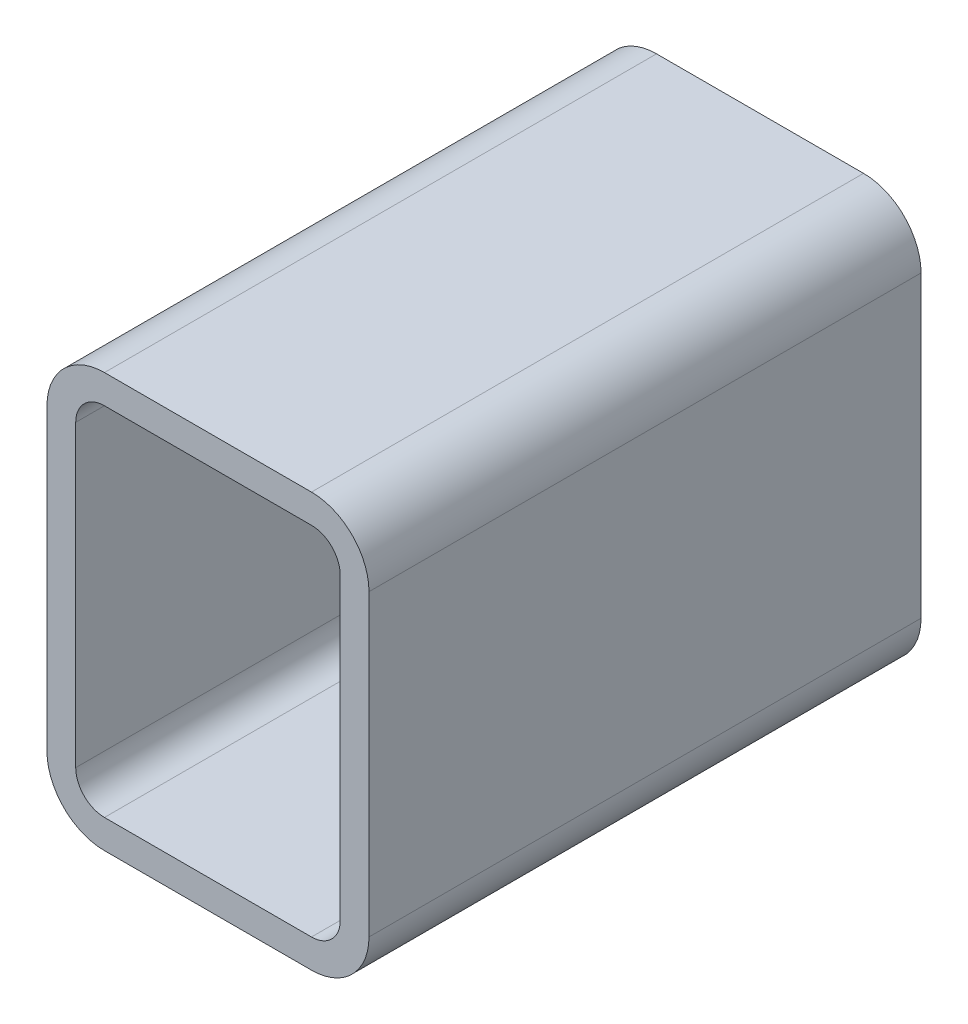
SolidWorks part; units mm, degrees
ref_plane "Front Plane" through (0, 0, 0) normal (0, 0, 1) x (1, 0, 0)
ref_plane "Top Plane" through (0, 0, 0) normal (0, 1, 0) x (1, 0, 0)
ref_plane "Right Plane" through (0, 0, 0) normal (1, 0, 0) x (0, 0, -1)
sketch "Sketch1" plane through (0, 0, 0) normal (0, 0, 1) x (1, 0, 0)
sketch_block_instance "HSS9x7x0.625-1"
sketch_block "HSS9x7x0.625"
extrude "Boss-Extrude1" add sketch "Sketch1" along normal blind 304.8
